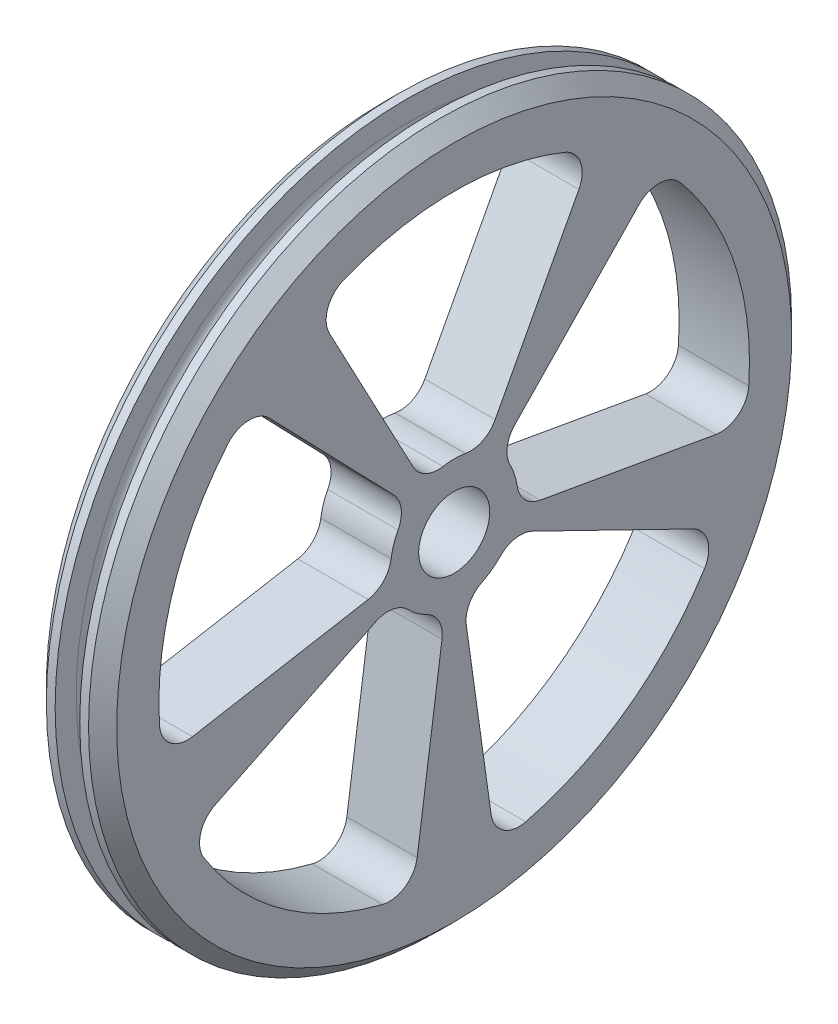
SolidWorks part; units mm, degrees
ref_plane "Plan de face" through (0, 0, 0) normal (0, 0, 1) x (1, 0, 0)
ref_plane "Plan de dessus" through (0, 0, 0) normal (0, 1, 0) x (1, 0, 0)
ref_plane "Plan de droite" through (0, 0, 0) normal (1, 0, 0) x (0, 0, -1)
sketch "Esquisse1" plane through (0, 0, 0) normal (0, 0, 1) x (1, 0, 0)
  line L0 (1.75, 47) -> (1.75, 50)
  line L2 (0, 0) -> (0, 64.3895) construction
  line L3 (1.75, 50) -> (5, 50)
  line L4 (5, 5.05) -> (5, 50)
  line L5 (1.75, 50) -> (1.7383, 49.9446)
  line L6 (0, 0) -> (29.42, 0) construction
  line L8 (-1.75, 47) -> (-1.75, 50)
  line L9 (-5, 5.05) -> (0, 5.05)
  line L11 (5, 5.05) -> (0, 5.05)
  line L16 (-5, 5.05) -> (-5, 50)
  line L17 (-1.75, 50) -> (-5, 50)
  arc A0 (1.75, 47) -> (-1.75, 47) centre (0, 47) cw
  point P2 (0, 47)
  dimension "D7" = 3
  dimension "D9" = 1.75
  dimension "D1" = 50
  dimension "D3" = 5.05
  dimension "D5" = 10
revolve "Révolution2" add sketch "Esquisse1" angle 360 about L6
chamfer "Chanfrein1" distance 2 angle 45 2 edges at (5, -50, 0) (-5, -50, 0)
sketch "Esquisse2" plane through (-5, 0, 0) normal (-1, 0, 0) x (0, 0, 1)
  line L0 (-4.2487, 7.9907) -> (-19.7178, 37.0838)
  line L1 (0, 0) -> (0, 40.584) construction
  line L2 (4.2487, 7.9907) -> (19.7178, 37.0838)
  circle A3 centre (0, 0) radius 42
  arc A4 (19.7178, 37.0838) -> (-19.7178, 37.0838) centre (0, 0) ccw
  circle A6 centre (0, 0) radius 9.05
  arc A7 (4.2487, 7.9907) -> (-4.2487, 7.9907) centre (0, 0) ccw
  dimension "D3" = 28
  dimension "D1" = 6
  dimension "D2" = 4
extrude "Enlèv. mat.-Extru.1" cut sketch "Esquisse2" against normal through all
fillet "Congé1" radius 4 4 edges at (0, 37.0838, 19.7178) (0, 7.9907, 4.2487) (0, 7.9907, -4.2487) (0, 37.0838, -19.7178)
pattern_circular "Répétition circulaire2" count 5 over 360 about axis through (0, 0, 0) along (1, 0, 0) of "Congé1", "Enlèv. mat.-Extru.1"
